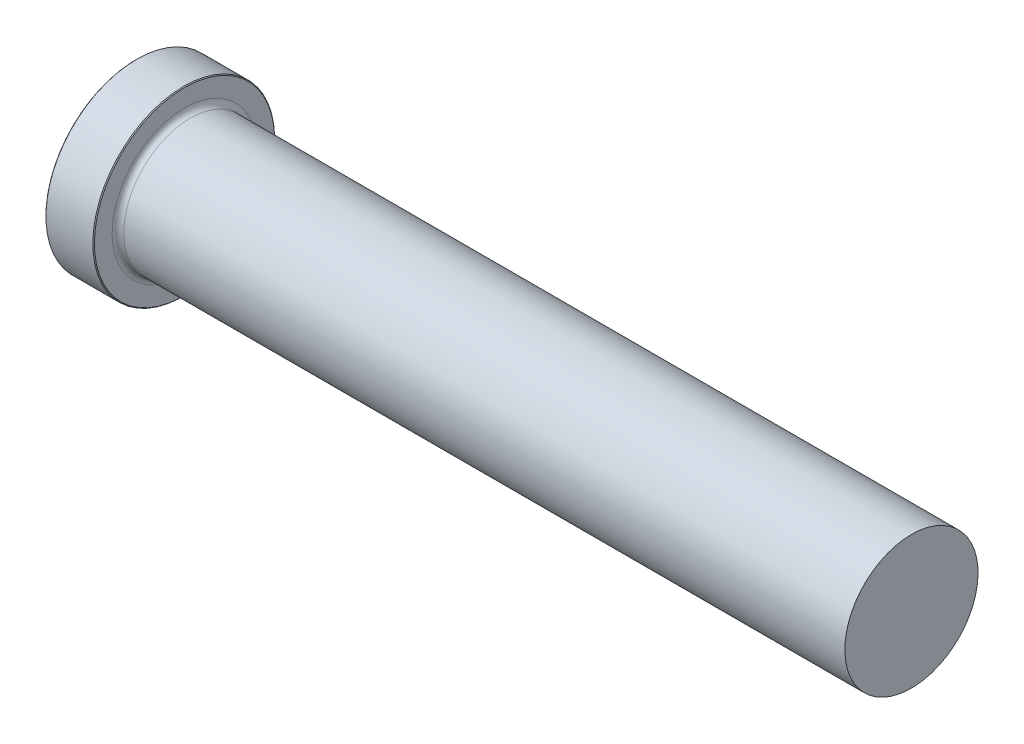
SolidWorks part; units mm, degrees
ref_plane "Front Plane" through (0, 0, 0) normal (0, 0, 1) x (1, 0, 0)
ref_plane "Top Plane" through (0, 0, 0) normal (0, 1, 0) x (1, 0, 0)
ref_plane "Right Plane" through (0, 0, 0) normal (1, 0, 0) x (0, 0, -1)
sketch "Sketch1" plane through (0, 0, 0) normal (0, 0, 1) x (1, 0, 0)
  line L0 (0, 0) -> (0, 11.9062)
  line L1 (0, 11.9062) -> (6.35, 11.9062)
  line L2 (6.35, 11.9062) -> (6.35, 9.4869)
  line L3 (7.112, 8.7249) -> (101.6, 8.7249)
  line L4 (101.6, 8.7249) -> (101.6, 0)
  line L5 (101.6, 0) -> (0, 0)
  line L6 (101.6, 0) -> (101.6, -8.7249) construction
  line L7 (101.6, -8.7249) -> (6.35, -8.7249) construction
  line L8 (0, 0) -> (0, -11.9062) construction
  line L9 (0, -11.9062) -> (6.35, -11.9062) construction
  line L10 (6.35, -11.9062) -> (6.35, -8.7249) construction
  arc A0 (6.35, 9.4869) -> (7.112, 8.7249) centre (7.112, 9.4869) ccw
  dimension "D4" = 0.762
  dimension "L" = 101.6
  dimension "D" = 17.4498
  dimension "H" = 23.8125
  dimension "T" = 6.35
revolve "Revolve1" add sketch "Sketch1" angle 360 about L5
chamfer "Chamfer1" distance 0.1016 angle 45 2 edges at (0, 11.9062, 0) (6.35, 11.9063, 0)
